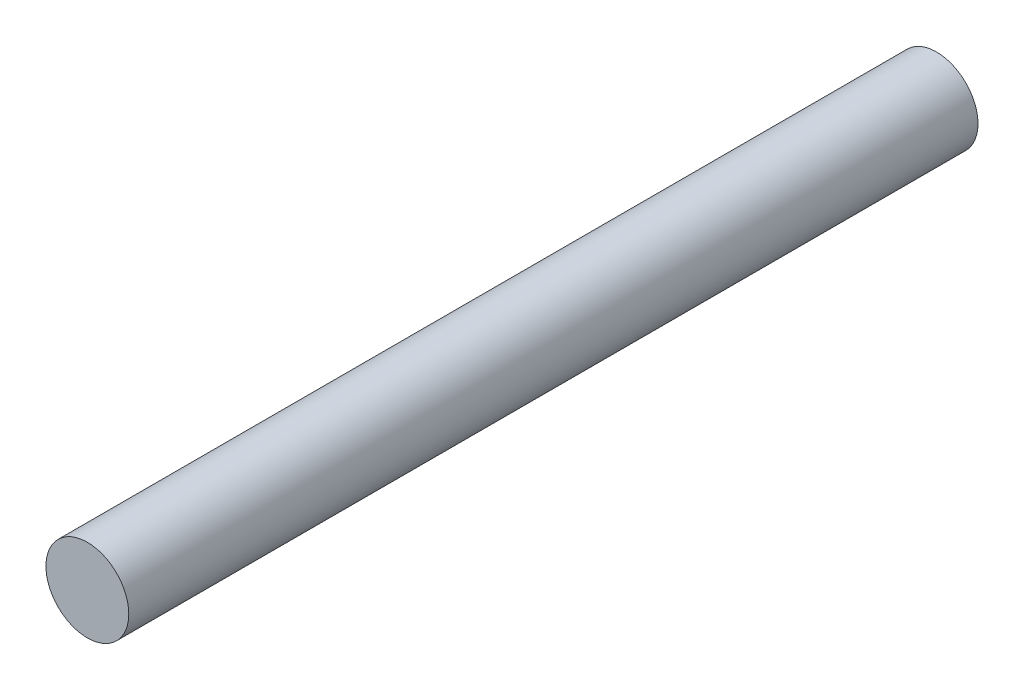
SolidWorks part; units mm, degrees
ref_plane "Front Plane" through (0, 0, 0) normal (0, 0, 1) x (1, 0, 0)
ref_plane "Top Plane" through (0, 0, 0) normal (0, 1, 0) x (1, 0, 0)
ref_plane "Right Plane" through (0, 0, 0) normal (1, 0, 0) x (0, 0, -1)
sketch "Sketch1" plane through (0, 0, 0) normal (0, 0, 1) x (1, 0, 0)
  circle A0 centre (0, 0) radius 4
  dimension "D1" = 8
extrude "Boss-Extrude1" add sketch "Sketch1" along normal blind 82
equation "\"Base-Width\"= 420"
equation "\"Base-Height\"= 320"
equation "\"Support-Rod-Diameter\"= 16"
equation "\"Support-Rod-X-Offset\"= 35"
equation "\"Support-Rod-Y-Offset\"= 35"
equation "\"Base-Thickness\"= 5"
equation "\"Base-Depth\"= 82"
equation "\"Corner-Radius-Major\"= \"Support-Rod-Diameter\""
equation "\"Cutout-Horizontal\"= \"Base-Width\" * 0.8"
equation "\"Cutout-Vertical\"= \"Base-Height\" * 0.6"
equation "\"Outer-Support-Bore-Diameter\"= 6.1"
equation "\"Inner-Support-Bore-Diameter\"= 8.2"
equation "\"Cutout-Depth\"= 20"
equation "\"D1@Boss-Extrude1\"=\"Base-Depth\""
equation "\"D2@Sketch1\"=\"Base-Width\""
equation "\"D1@Sketch7\"=\"Cutout-Vertical\""
equation "\"D2@Sketch6\"=\"Cutout-Horizontal\""
equation "\"D2@Sketch8\"= \"Base-Width\" - ( \"Support-Rod-X-Offset\" ) + 5"
equation "\"D1@Sketch8\" = \"Base-Height\" - \"Support-Rod-Y-Offset\" + 10"
equation "\"D1@Major-Fillet\" = \"Corner-Radius-Major\""
equation "\"D1@Sketch1\"=\"Base-Height\""
